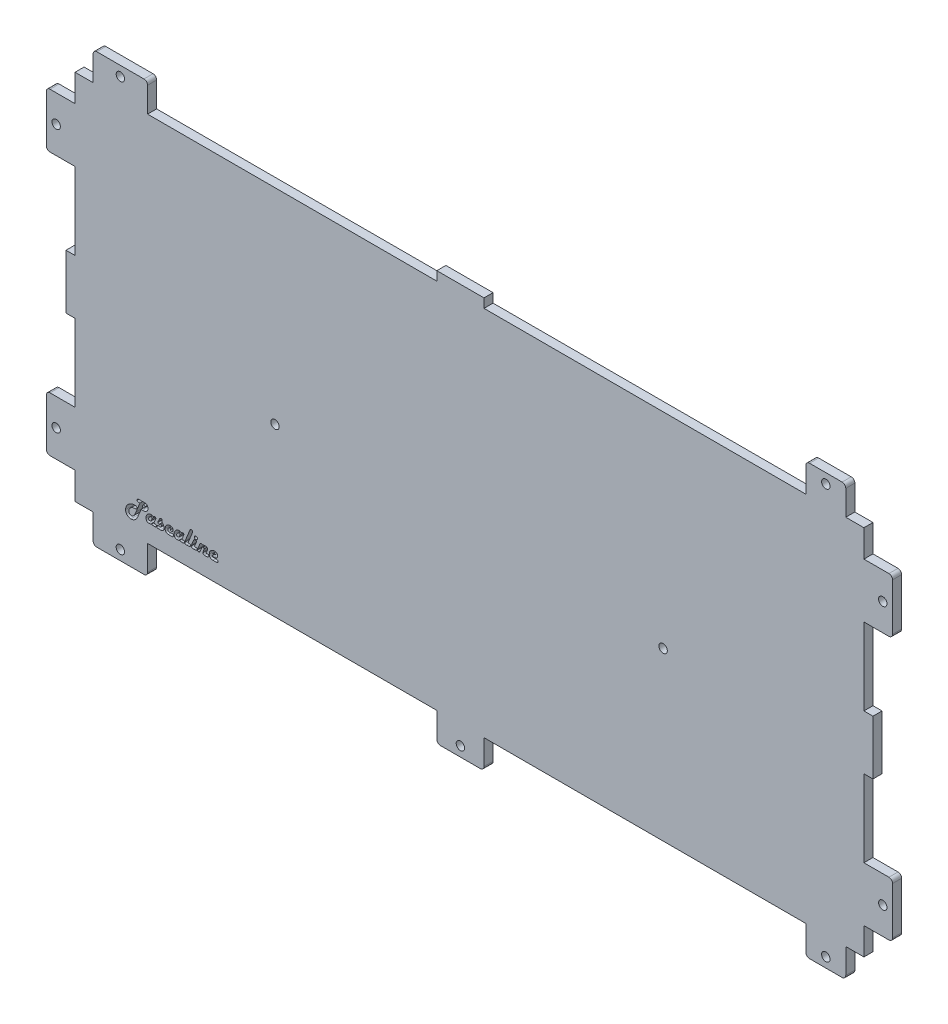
SolidWorks part; units mm, degrees
ref_plane "Front Plane" through (0, 0, 0) normal (0, 0, 1) x (1, 0, 0)
ref_plane "Top Plane" through (0, 0, 0) normal (0, 1, 0) x (1, 0, 0)
ref_plane "Right Plane" through (0, 0, 0) normal (1, 0, 0) x (0, 0, -1)
sketch "Sketch1" plane through (0, 0, 0) normal (0, 0, 1) x (1, 0, 0)
  line L1 (0, 0) -> (276.225, 0)
  line L2 (0, 0) -> (0, 130.175)
  line L3 (0, 130.175) -> (276.225, 130.175)
  line L4 (276.225, 0) -> (276.225, 130.175)
  dimension "D1" = 276.225
  dimension "D2" = 130.175
extrude "Boss-Extrude1" add sketch "Sketch1" along normal blind 3.175
sketch "Sketch2" plane through (0, 0, 0) normal (0, 0, 1) x (1, 0, 0)
  line L1 (138.1125, 130.175) -> (138.1125, 0) construction
  line L2 (276.225, 130.175) -> (0, 130.175) construction
  line L3 (0, 0) -> (276.225, 0) construction
  line L4 (276.225, 65.0875) -> (0, 65.0875) construction
  line L5 (126.6825, 130.175) -> (143.1925, 130.175)
  line L6 (276.225, 0) -> (276.225, 130.175) construction
  line L7 (0, 130.175) -> (0, 0) construction
  line L8 (286.258, 9.525) -> (286.258, 28.575)
  line L9 (276.225, 120.65) -> (286.258, 120.65)
  line L10 (276.225, 120.65) -> (276.225, 101.6)
  line L11 (276.225, 101.6) -> (286.258, 101.6)
  line L12 (286.258, 120.65) -> (286.258, 101.6)
  line L13 (276.225, 74.6125) -> (279.4, 74.6125)
  line L14 (276.225, 74.6125) -> (276.225, 55.5625)
  line L15 (126.6825, 130.175) -> (126.6825, 133.35)
  line L16 (276.225, 55.5625) -> (279.4, 55.5625)
  line L17 (279.4, 74.6125) -> (279.4, 55.5625)
  line L18 (276.225, 28.575) -> (286.258, 28.575)
  line L19 (276.225, 9.525) -> (276.225, 28.575)
  line L20 (276.225, 9.525) -> (286.258, 9.525)
  line L21 (0, 9.525) -> (-10.033, 9.525)
  line L22 (0, 9.525) -> (0, 28.575)
  line L23 (0, 28.575) -> (-10.033, 28.575)
  line L24 (-3.175, 74.6125) -> (-3.175, 55.5625)
  line L25 (0, 55.5625) -> (-3.175, 55.5625)
  line L26 (0, 74.6125) -> (0, 55.5625)
  line L27 (0, 74.6125) -> (-3.175, 74.6125)
  line L28 (-10.033, 120.65) -> (-10.033, 101.6)
  line L29 (0, 101.6) -> (-10.033, 101.6)
  line L30 (0, 120.65) -> (0, 101.6)
  line L31 (0, 120.65) -> (-10.033, 120.65)
  line L32 (-10.033, 9.525) -> (-10.033, 28.575)
  line L33 (126.6825, 133.35) -> (143.1925, 133.35)
  line L34 (6.35, 0) -> (25.4, 0)
  line L35 (6.35, 0) -> (6.35, -10.033)
  line L36 (6.35, -10.033) -> (25.4, -10.033)
  line L37 (25.4, 0) -> (25.4, -10.033)
  line L38 (126.6825, 0) -> (143.1925, 0)
  line L39 (126.6825, 0) -> (126.6825, -10.033)
  line L40 (126.6825, -10.033) -> (143.1925, -10.033)
  line L41 (143.1925, 130.175) -> (143.1925, 133.35)
  line L42 (143.1925, 0) -> (143.1925, -10.033)
  line L44 (255.905, 0) -> (269.875, 0)
  line L45 (255.905, 0) -> (255.905, -10.033)
  line L46 (255.905, -10.033) -> (269.875, -10.033)
  line L47 (269.875, 0) -> (269.875, -10.033)
  line L48 (6.35, 130.175) -> (25.4, 130.175)
  line L49 (6.35, 130.175) -> (6.35, 140.208)
  line L50 (6.35, 140.208) -> (25.4, 140.208)
  line L51 (25.4, 130.175) -> (25.4, 140.208)
  line L52 (255.905, 130.175) -> (269.875, 130.175)
  line L53 (255.905, 130.175) -> (255.905, 140.208)
  line L54 (255.905, 140.208) -> (269.875, 140.208)
  line L55 (269.875, 130.175) -> (269.875, 140.208)
  point P20 (276.225, 65.0875)
  point P49 (134.9375, -10.033)
  dimension "D1" = 19.05
  dimension "D2" = 9.525
  dimension "D3" = 10.033
  dimension "D4" = 10.033
  dimension "D5" = 6.35
  dimension "D6" = 6.35
  dimension "D7" = 3.175
  dimension "D8" = 19.05
  dimension "D9" = 16.51
  dimension "D10" = 13.97
  dimension "D11" = 10.033
  dimension "D12" = 3.175
  dimension "D13" = 3.175
extrude "Boss-Extrude2" add sketch "Sketch2" along normal blind 3.175
hole_wizard "#4 Clearance Hole1" positions "Sketch5" profile "Sketch4" hole size "#4" standard "ANSI Inch"
sketch "Sketch5" plane through (0, 0, 3.175) normal (0, 0, 1) x (1, 0, 0)
  line L11 (25.4, 0) -> (126.6825, 0) construction
  line L12 (143.1925, 0) -> (255.905, 0) construction
  line L13 (126.6825, -10.033) -> (143.1925, -10.033) construction
  line L14 (-3.175, 65.0875) -> (279.4, 65.0875) construction
  line L15 (-3.175, 74.6125) -> (-3.175, 55.5625) construction
  line L16 (279.4, 55.5625) -> (279.4, 74.6125) construction
  line L18 (6.35, -10.033) -> (25.4, -10.033) construction
  line L19 (255.905, -10.033) -> (269.875, -10.033) construction
  line L20 (286.258, 101.6) -> (286.258, 120.65) construction
  line L21 (276.225, 74.6125) -> (276.225, 101.6) construction
  line L22 (138.1125, 23.6458) -> (138.1125, 106.5292) construction
  point P0 (70.0139, 58.42)
  point P2 (205.9039, 58.42)
  point P7 (134.9375, -6.604)
  point P65 (134.9375, -10.033)
  point P66 (15.875, -6.604)
  point P68 (262.89, -6.604)
  point P80 (15.875, -10.033)
  point P83 (262.89, -10.033)
  point P85 (262.89, 136.779)
  point P86 (15.875, 136.779)
  point P87 (282.829, 111.125)
  point P91 (286.258, 111.125)
  point P95 (282.829, 19.05)
  point P99 (138.1125, 65.0875)
  point P100 (138.1125, 65.0875)
  point P101 (-6.604, 111.125)
  point P102 (-6.604, 19.05)
  dimension "D1" = 135.89
  dimension "D2" = 58.42
  dimension "D3" = 6.604
  dimension "D4" = 64.9236
  dimension "D5" = 6.604
sketch "Sketch4" plane through (70.0139, 58.42, 3.175) normal (1, 0, 0) x (0, -1, 0)
  line L0 (0, 0) -> (0, 3.302)
  line L1 (0, 3.302) -> (1.4732, 3.302)
  line L2 (1.4732, 3.302) -> (1.4732, 0)
  line L5 (1.4732, 0) -> (0, 0)
  line L10 (0, 3.302) -> (-1.4732, 3.302) construction
  line L11 (0, -6.35) -> (0, 107.95) construction
  dimension "Hole Dia." = 2.9464
  dimension "Hole Depth" = 3.302
  dimension "Drill Angle" = 180
fillet "Fillet1" radius 1.27 18 edges at (6.35, 140.208, 1.5875) (25.4, 140.208, 1.5875) (255.905, 140.208, 1.5875) (269.875, 140.208, 1.5875) (269.875, -10.033, 1.5875) (255.905, -10.033, 1.5875) (143.1925, -10.033, 1.5875) (126.6825, -10.033, 1.5875) (25.4, -10.033, 1.5875) (6.35, -10.033, 1.5875) (-10.033, 120.65, 1.5875) (-10.033, 28.575, 1.5875) (-10.033, 101.6, 1.5875) (-10.033, 9.525, 1.5875) (286.258, 120.65, 1.5875) (286.258, 101.6, 1.5875) (286.258, 28.575, 1.5875) (286.258, 9.525, 1.5875)
sketch "Sketch6" plane through (0, 0, 3.175) normal (0, 0, 1) x (1, 0, 0)
  text T0 "Pascaline" font "Harlow Solid Italic" height in points 18
  dimension "D1" = 6.35
  dimension "D2" = 17.78
extrude "Cut-Extrude1" cut sketch "Sketch6" against normal through all
